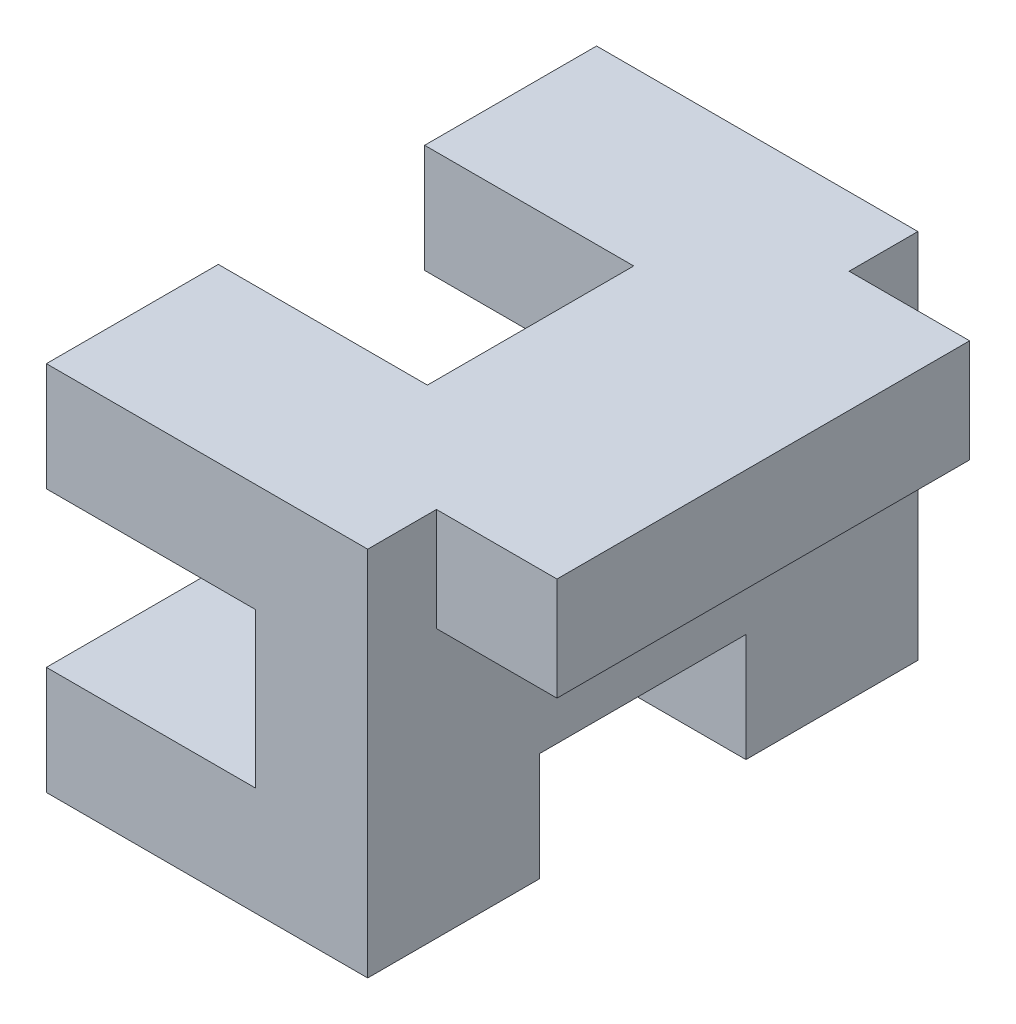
SolidWorks part; units mm, degrees
ref_plane "FRONT" through (0, 0, 0) normal (0, 0, 1) x (1, 0, 0)
ref_plane "TOP" through (0, 0, 0) normal (0, 1, 0) x (1, 0, 0)
ref_plane "SIDE" through (0, 0, 0) normal (1, 0, 0) x (0, 0, -1)
sketch "Sketch1" plane through (0, 0, 0) normal (0, 0, 1) x (1, 0, 0)
  line L0 (-30.1752, 17.145) -> (-30.1752, 7.1374)
  line L1 (-30.1752, -17.145) -> (0, -17.145)
  line L2 (0, -17.145) -> (0, 7.62)
  line L3 (0, 7.62) -> (11.1252, 7.62)
  line L4 (11.1252, 7.62) -> (11.1252, 17.145)
  line L5 (11.1252, 17.145) -> (-30.1752, 17.145)
  line L6 (-30.1752, 7.1374) -> (-10.3632, 7.1374)
  line L7 (-10.3632, 7.1374) -> (-10.3632, -7.1374)
  line L8 (-10.3632, -7.1374) -> (-30.1752, -7.1374)
  line L9 (-30.1752, -7.1374) -> (-30.1752, -17.145)
  dimension "D1" = 9.525
  dimension "D2" = 11.1252
  dimension "D3" = 30.1752
  dimension "D4" = 19.812
  dimension "D5" = 14.2748
  dimension "D6" = 7.1374
  dimension "D7" = 17.145
  dimension "D8" = 17.145
extrude "Base-Extrude" add sketch "Sketch1" along normal mid plane 50.8
sketch "Sketch2" plane through (0, 0, 0) normal (0, 1, 0) x (1, 0, 0)
  line L0 (-30.1752, -25.4) -> (-30.1752, 25.4) construction
  line L1 (-30.1752, 9.525) -> (-10.3632, 9.525)
  line L2 (-30.1752, 9.525) -> (-30.1752, -9.525)
  line L3 (-30.1752, -9.525) -> (-10.3632, -9.525)
  line L4 (-10.3632, 9.525) -> (-10.3632, -9.525)
  line L5 (-10.3632, -25.4) -> (-10.3632, 25.4) construction
  dimension "D1" = 9.525
  dimension "D2" = 9.525
extrude "Cut-Extrude1" cut sketch "Sketch2" against normal through all and the other way through all
sketch "Sketch3" plane through (0, 0, 0) normal (1, 0, 0) x (0, 0, -1)
  line L0 (-25.4, -17.145) -> (25.4, -17.145) construction
  line L1 (9.525, -17.145) -> (-9.525, -17.145)
  line L2 (9.525, -17.145) -> (9.525, -7.1374)
  line L3 (9.525, -7.1374) -> (-9.525, -7.1374)
  line L4 (-9.525, -17.145) -> (-9.525, -7.1374)
  line L5 (9.525, -7.1374) -> (25.4, -7.1374) construction
  dimension "D1" = 9.525
  dimension "D2" = 9.525
extrude "Cut-Extrude2" cut sketch "Sketch3" against normal through all
chamfer "Chamfer1" distance 0.508 angle 45
sketch "Sketch4" plane through (0, 17.145, 0) normal (0, 1, 0) x (-1, 0, 0)
  line L0 (0, 25.4) -> (0, -25.4) construction
  line L1 (-11.1252, 25.4) -> (0, 25.4)
  line L2 (-11.1252, 25.4) -> (-11.1252, 19.05)
  line L3 (-11.1252, 19.05) -> (0, 19.05)
  line L4 (0, 25.4) -> (0, 19.05)
  line L6 (-11.1252, -25.4) -> (0, -25.4)
  line L7 (-11.1252, -25.4) -> (-11.1252, -19.05)
  line L8 (-11.1252, -19.05) -> (0, -19.05)
  line L9 (0, -25.4) -> (0, -19.05)
  dimension "D1" = 6.35
  dimension "D2" = 6.35
extrude "Cut-Extrude3" cut sketch "Sketch4" against normal through all
